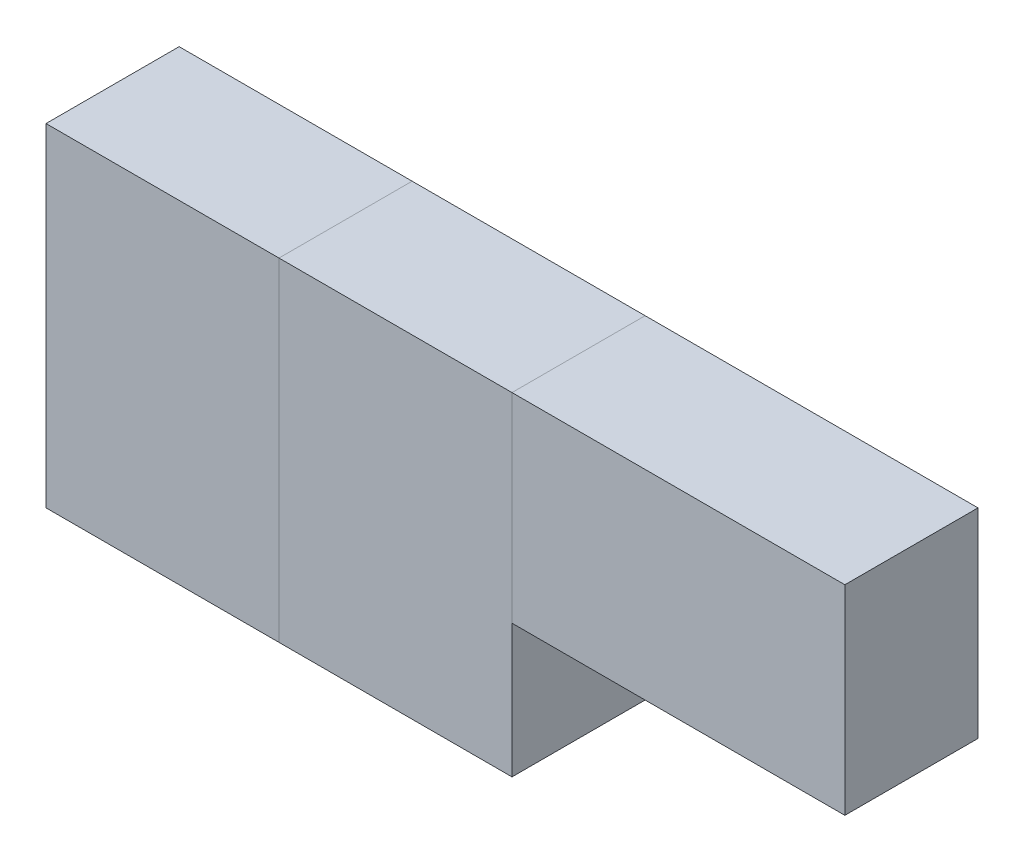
SolidWorks part; units mm, degrees
ref_plane "Front Plane" through (0, 0, 0) normal (0, 0, 1) x (1, 0, 0)
ref_plane "Top Plane" through (0, 0, 0) normal (0, 1, 0) x (1, 0, 0)
ref_plane "Right Plane" through (0, 0, 0) normal (1, 0, 0) x (0, 0, -1)
sketch "Sketch1" plane through (0, 0, 0) normal (0, 0, 1) x (1, 0, 0)
  line L1 (0, 762) -> (533.4, 762)
  line L2 (0, 762) -> (0, 0)
  line L3 (0, 0) -> (533.4, 0)
  line L4 (533.4, 762) -> (533.4, 0)
  dimension "D1" = 533.4
  dimension "D2" = 762
extrude "Boss-Extrude1" add sketch "Sketch1" along normal blind 304.8
pattern_linear "LPattern1" count 2 spacing 533.4 along (1, 0, 0)
sketch "Sketch2" plane through (1066.8, 0, 0) normal (1, 0, 0) x (0, 0, -1)
  line L0 (0, 0) -> (0, 762) construction
  line L1 (-304.8, 762) -> (0, 762)
  line L2 (-304.8, 762) -> (-304.8, 304.8)
  line L3 (-304.8, 304.8) -> (0, 304.8)
  line L4 (0, 762) -> (0, 304.8)
  dimension "D1" = 457.2
extrude "Boss-Extrude2" add sketch "Sketch2" along normal blind 762 separate body
